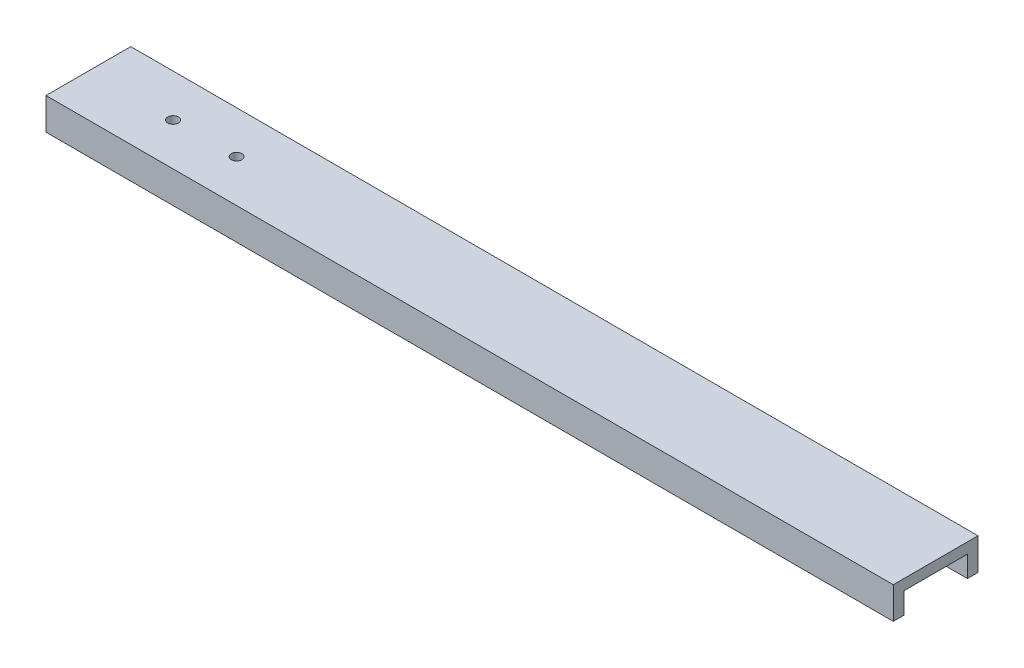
SolidWorks part; units mm, degrees
ref_plane "Front Plane" through (0, 0, 0) normal (0, 0, 1) x (1, 0, 0)
ref_plane "Top Plane" through (0, 0, 0) normal (0, 1, 0) x (1, 0, 0)
ref_plane "Right Plane" through (0, 0, 0) normal (1, 0, 0) x (0, 0, -1)
sketch "Sketch2" plane through (0, 0, 0) normal (1, 0, 0) x (0, 0, -1)
  line L0 (-25.4, -12.7) -> (-25.4, 6.35)
  line L2 (-25.4, 6.35) -> (25.4, 6.35)
  line L3 (25.4, 6.35) -> (25.4, -12.7)
  line L4 (25.4, -12.7) -> (19.05, -12.7)
  line L5 (19.05, -12.7) -> (19.05, 0)
  line L7 (19.05, 0) -> (-19.05, 0)
  line L8 (-19.05, 0) -> (-19.05, -12.7)
  line L9 (-19.05, -12.7) -> (-25.4, -12.7)
  line L10 (0, 0) -> (0, 6.35) construction
  point P2 (-19.05, 5.103)
  dimension "D1" = 50.8
  dimension "D2" = 6.35
  dimension "D3" = 19.05
extrude "Boss-Extrude2" add sketch "Sketch2" along normal mid plane 508
sketch "Sketch3" plane through (0, 6.35, 0) normal (0, 1, 0) x (1, 0, 0)
  line L0 (-254, 0) -> (-165.1, 0) construction
  line L1 (-254, 25.4) -> (-254, -25.4) construction
  circle A0 centre (-203.2, 0) radius 3.175
  circle A1 centre (-165.1, 0) radius 3.175
  point P9 (0, 0)
  point P10 (0, 0)
  point P11 (-233.7232, 0)
  dimension "D1" = 6.35
  dimension "D2" = 50.8
  dimension "D3" = 38.1
extrude "Cut-Extrude1" cut sketch "Sketch3" against normal through all
